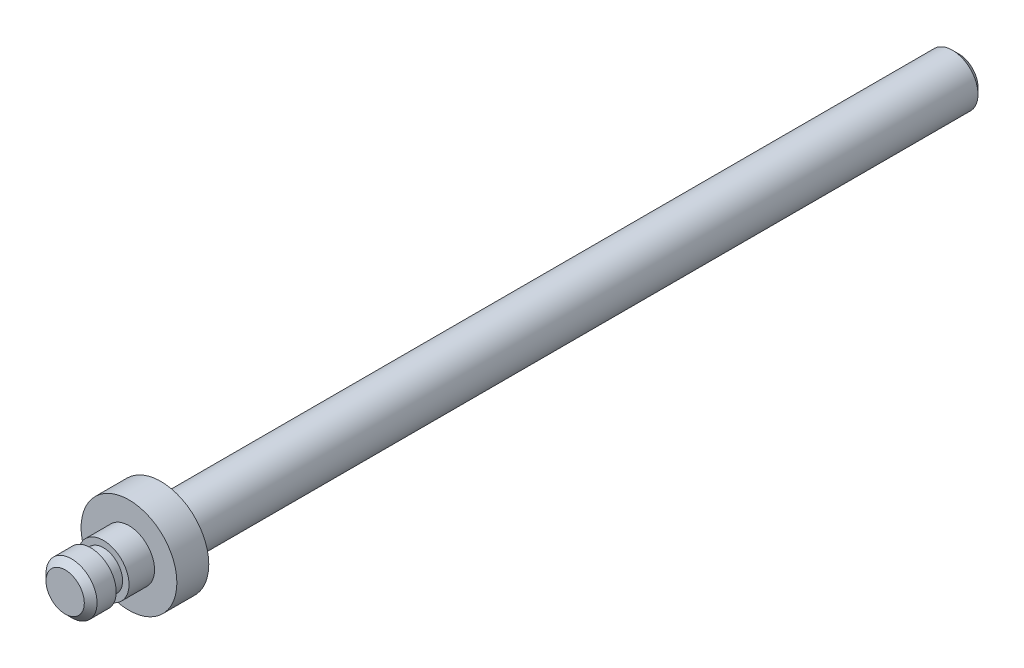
SolidWorks part; units mm, degrees
ref_plane "前视基准面" through (0, 0, 0) normal (0, 0, 1) x (1, 0, 0)
ref_plane "上视基准面" through (0, 0, 0) normal (0, 1, 0) x (1, 0, 0)
ref_plane "右视基准面" through (0, 0, 0) normal (1, 0, 0) x (0, 0, -1)
sketch "草图1" plane through (0, 0, 0) normal (0, 0, 1) x (1, 0, 0)
  circle A0 centre (0, 0) radius 4
  dimension "D1" = 8
extrude "凸台-拉伸1" add sketch "草图1" along normal blind 125
sketch "草图2" plane through (0, 0, 125) normal (0, 0, 1) x (1, 0, 0)
  circle A0 centre (0, 0) radius 7.5
  dimension "D1" = 15
extrude "凸台-拉伸2" add sketch "草图2" along normal blind 5
sketch "草图3" plane through (0, 0, 130) normal (0, 0, 1) x (1, 0, 0)
  circle A0 centre (0, 0) radius 4
  dimension "D1" = 8
extrude "凸台-拉伸3" add sketch "草图3" along normal blind 10
chamfer "倒角1" distance 1 angle 45 2 edges at (4, 0, 0) (4, 0, 140)
sketch "草图5" plane through (0, 0, 140) normal (0, 0, 1) x (1, 0, 0)
  circle A0 centre (0, 0) radius 4
  circle A1 centre (0, 0) radius 3
  dimension "D1" = 6
  dimension "D2" = 8
extrude "切除-拉伸2" cut sketch "草图5" against normal blind 2 from offset 4
